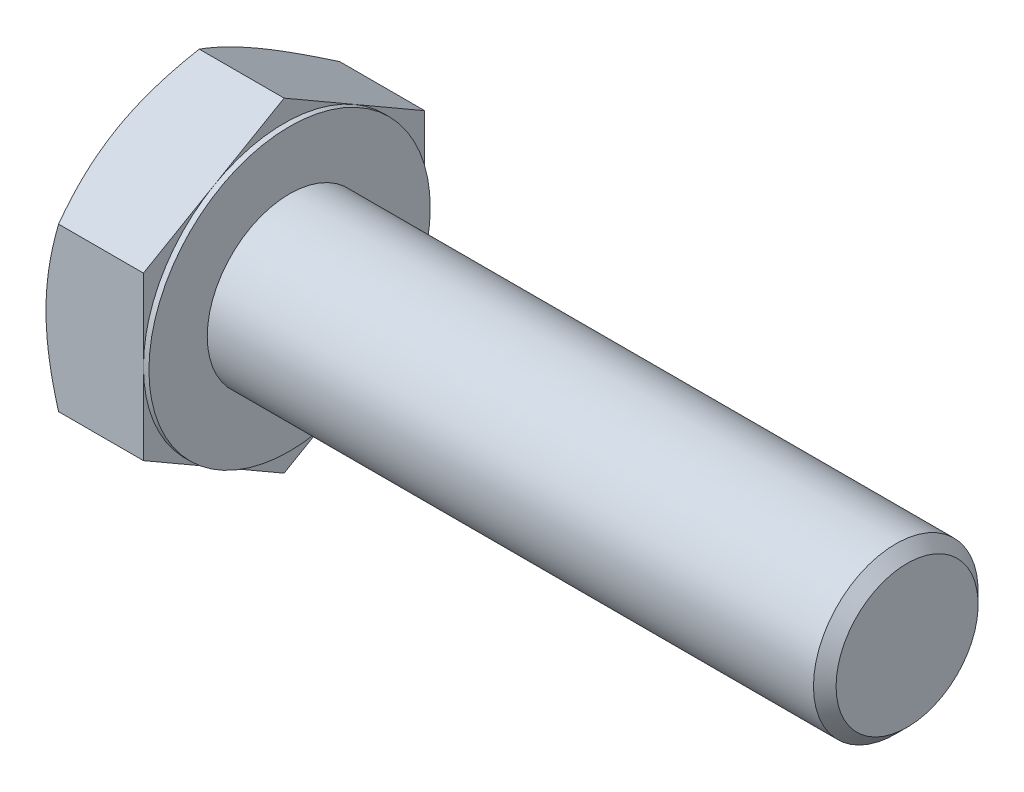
SolidWorks part; units mm, degrees
extrude "BaseHead" add sketch "Sketch1" along normal blind 15
sketch "Sketch1" plane through (0, 0, 0) normal (1, 0, 0) x (0, 0, -1)
  line L0 (20.5, 11.8357) -> (20.5, -11.8357)
  line L1 (-20.5, 11.8357) -> (-20.5, -11.8357)
  line L2 (20.5, -11.8357) -> (0, -23.6714)
  line L3 (0, -23.6714) -> (-20.5, -11.8357)
  line L4 (20.5, 11.8357) -> (0, 23.6714)
  line L5 (0, 23.6714) -> (-20.5, 11.8357)
revolve "HeadChamfer" cut sketch "Sketch3" angle 360 about L6
sketch "Sketch3" plane through (0, 0, 0) normal (0, 0, 1) x (1, 0, 0)
  line L0 (0, 20.5) -> (4.7177, 28.6714)
  line L1 (0, 23.6714) -> (0, 11.8357) construction
  line L2 (4.7177, 28.6714) -> (4.7177, 33.6714)
  line L3 (4.7177, 33.6714) -> (-10, 33.6714)
  line L4 (-10, 33.6714) -> (-10, 20.5)
  line L5 (-10, 20.5) -> (0, 20.5)
  line L6 (0, 0) -> (99.06, 0) construction
  line L7 (15, 23.6714) -> (0, 23.6714) construction
ref_plane "Plane1" through (0, 0, 0) normal (0, 0, 1) x (1, 0, 0)
ref_plane "Plane2" through (0, 0, 0) normal (0, 1, 0) x (1, 0, 0)
ref_plane "Plane3" through (0, 0, 0) normal (1, 0, 0) x (0, 0, -1)
other "Configuration Table"
sketch "BodySke" plane through (0, 0, 0) normal (0, 0, 1) x (1, 0, 0)
  line L0 (0, 11.8357) -> (0, -11.8357) construction
  line L1 (0, 0) -> (105, 0)
  line L2 (0, 0) -> (0, 12)
  line L3 (0, 12) -> (103.352, 12)
  line L4 (105, 0) -> (105, 10.352)
  line L5 (15, 23.6714) -> (15, 11.8357) construction
  line L6 (105, 10.352) -> (103.352, 12)
  line L7 (0, 0) -> (96.52, 0) construction
  line L8 (105, -10.352) -> (103.352, -12) construction
  line L9 (0, -12) -> (103.352, -12) construction
  line L10 (18, 15.24) -> (18, -1.27) construction
  line L11 (51, 15.24) -> (51, -1.27) construction
  line L12 (15, 11.8357) -> (15, -11.8357) construction
revolve "BaseBody" add sketch "BodySke"
fillet "HeadFillet" [suppressed] radius 0.8
sketch "Sketch5" plane through (0, 0, 0) normal (0, 0, 1) x (1, 0, 0)
  line L0 (15, 20.5) -> (10.2823, 28.6714)
  line L1 (15, 23.6714) -> (15, 11.8357) construction
  line L2 (10.2823, 28.6714) -> (10.2823, 33.6714)
  line L3 (10.2823, 33.6714) -> (20.2823, 33.6714)
  line L4 (20.2823, 33.6714) -> (20.2823, 20.5)
  line L5 (20.2823, 20.5) -> (15, 20.5)
  line L7 (15, 23.6714) -> (1.831, 23.6714) construction
  line L8 (0, 0) -> (99.06, 0) construction
  line L9 (0, 0) -> (99.06, 0) construction
revolve "UnderHeadChamfer" [suppressed] cut sketch "Sketch5" angle 360 about L8
sketch "Sketch4" plane through (0, 0, 0) normal (0, 0, 1) x (1, 0, 0)
  line L1 (15, 23.6714) -> (15, 11.8357) construction
  line L2 (15, 20.5) -> (14.2, 20.5)
  line L3 (15, 20.5) -> (15, 33.6714)
  line L4 (15, 33.6714) -> (14.2, 33.6714)
  line L5 (0, 0) -> (95.25, 0) construction
  line L6 (0, 0) -> (96.52, 0) construction
  line L7 (14.2, 20.5) -> (14.2, 33.6714)
  line L8 (15, 23.6714) -> (1.831, 23.6714) construction
revolve "BearingFace" cut sketch "Sketch4" angle 360 about L5
sketch "ThdSchSke" plane through (0, 0, 0) normal (0, 0, 1) x (1, 0, 0)
  line L0 (51, -10.352) -> (49.8461, -12)
  line L1 (51, -10.352) -> (52.1539, -12)
  line L2 (52.1539, -12) -> (52.1539, -15)
  line L3 (-3.175, 0) -> (5.1513, 0) construction
  line L5 (52.1539, -15) -> (49.8461, -15)
  line L6 (49.8461, -15) -> (49.8461, -12)
revolve "ThreadSchematic" [suppressed] cut sketch "ThdSchSke" angle 360 about L3
pattern_linear "ThdSchPat" [suppressed]
equation "\"D3@Sketch1\" = \"Width_flats@Sketch1\" / 2"
equation "\"D4@Sketch1\" = \"D3@Sketch1\""
equation "\"D5@Sketch1\" = \"D4@Sketch1\""
equation "\"Thread_minor@ThreadCosmetic\" = \"Minor_dia@BodySke\""
equation "\"D1@Sketch3\" = \"Width_flats@Sketch1\" / 2"
equation "\"D1@Sketch5\" = \"Width_flats@Sketch1\" / 2"
equation "\"Head_ch_ang@Sketch5\" = \"Head_ch_ang@Sketch3\""
equation "\"D1@Sketch4\" = \"Width_flats@Sketch1\""
equation "\"Thread_length@ThreadCosmetic\" = ((sgn( (\"Length@BodySke\" - \"Advance@BodySke\" ) - \"Thread_nom@BodySke\" )-1)*( (\"Length@BodySke\" - \"Advance@BodySke\" ) - \"Thread_nom@BodySke\" ))/-2+ \"Thread_nom@BodySke\""
equation "\"Thread_minor@ThdSchSke\" = \"Minor_dia@BodySke\""
equation "\"Diameter@ThdSchSke\" = \"Diameter@BodySke\""
equation "\"Overcut@ThdSchSke\" = \"Diameter@BodySke\" * 1.25"
equation "\"Start@ThdSchSke\" = \"Head_ht@BaseHead\" + \"Length@BodySke\" - \"Thread_length@ThreadCosmetic\"  '---Non-countersunk---"
equation "\"Num_threads@ThdSchPat\" = int( \"Thread_length@ThreadCosmetic\" / \"Advance@BodySke\" + 0.999 )  + 1"
equation "\"Advance@ThdSchPat\" = \"Thread_length@ThreadCosmetic\" /  (\"Num_threads@ThdSchPat\" - 1) 'relax it"
equation "\"Num_threads@ThdSchPat\" = \"Num_threads@ThdSchPat\" - sgn( \"Num_threads@ThdSchPat\" - 1) '---chamfered tips only---"
